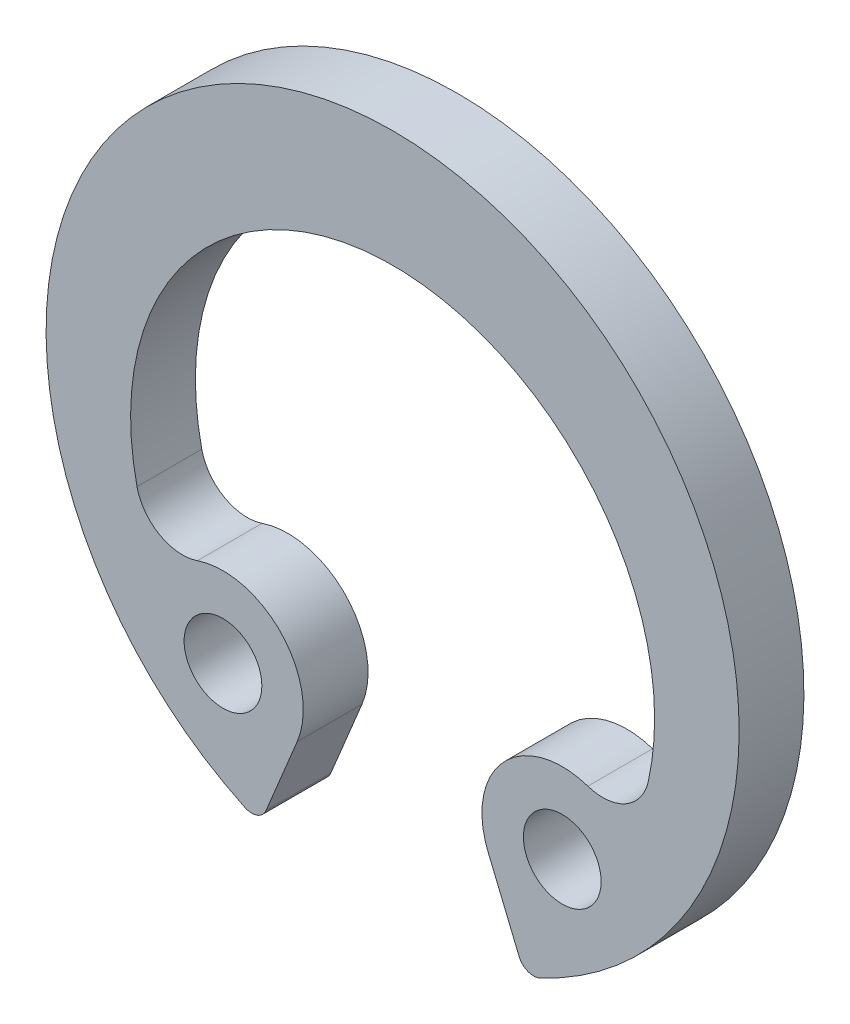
SolidWorks part; units mm, degrees
ref_plane "Front Plane" through (0, 0, 0) normal (0, 0, 1) x (1, 0, 0)
ref_plane "Top Plane" through (0, 0, 0) normal (0, 1, 0) x (1, 0, 0)
ref_plane "Right Plane" through (0, 0, 0) normal (1, 0, 0) x (0, 0, -1)
sketch "BodySke" plane through (0, 0, 0) normal (0, 0, 1) x (1, 0, 0)
  line L0 (0, -7.6074) -> (0, 7.215) construction
  line L1 (1.4734, -3.5572) -> (2.0474, -4.9428)
  line L2 (-1.4734, -3.5572) -> (-2.0474, -4.9428)
  line L3 (2.0474, -4.9428) -> (5.9992, -4.9428) construction
  line L4 (3.0935, -1.9371) -> (3.6777, -2.1791)
  line L5 (-3.0935, -1.9371) -> (-3.6777, -2.1791)
  arc A0 (2.0474, -4.9428) -> (-2.0474, -4.9428) centre (0, 0) ccw
  arc A1 (0, -4.54) -> (3.6046, -2.3304) centre (0, -0.495) ccw construction
  circle A2 centre (2.619, -3.0827) radius 0.6
  circle A3 centre (0, 0) radius 4.045 construction
  circle A4 centre (-2.619, -3.0827) radius 0.6
  arc A5 (-3.6777, -2.1791) -> (3.6777, -2.1791) centre (0, -0.495) cw
  arc A6 (3.6046, -2.3304) -> (3.4297, -2.1445) centre (2.619, -3.0827) ccw construction
  arc A8 (3.0935, -1.9371) -> (1.4734, -3.5572) centre (2.619, -3.0827) ccw
  arc A9 (3.6777, -2.1791) -> (-3.6777, -2.1791) centre (0, -0.495) ccw
  arc A10 (-3.0935, -1.9371) -> (-1.4734, -3.5572) centre (-2.619, -3.0827) cw
  dimension "D1" = 45
  dimension "Groove_Diameter" = 10.7
  dimension "D2" = 22.5
  dimension "D3" = 8.09
  dimension "Hole_dia" = 1.2
  dimension "Groove_depth" = 1.8
  dimension "Groove_length" = 3.1
extrude "BaseBody" add sketch "BodySke" along normal blind 1
fillet "Fillet1" radius 0.72 2 edges at (3.6777, -2.1791, 0.5) (-3.6777, -2.1791, 0.5)
fillet "Fillet2" radius 0.24 2 edges at (2.0474, -4.9428, 0.5) (-2.0474, -4.9428, 0.5)
equation "\"D3@BodySke\" = \"Groove_Diameter@BodySke\" - 1.45 * \"Groove_depth@BodySke\""
equation "\"D1@Fillet1\" = \"Hole_dia@BodySke\" * 0.6"
equation "\"D1@Fillet2\" = \"Hole_dia@BodySke\" * 0.2"
